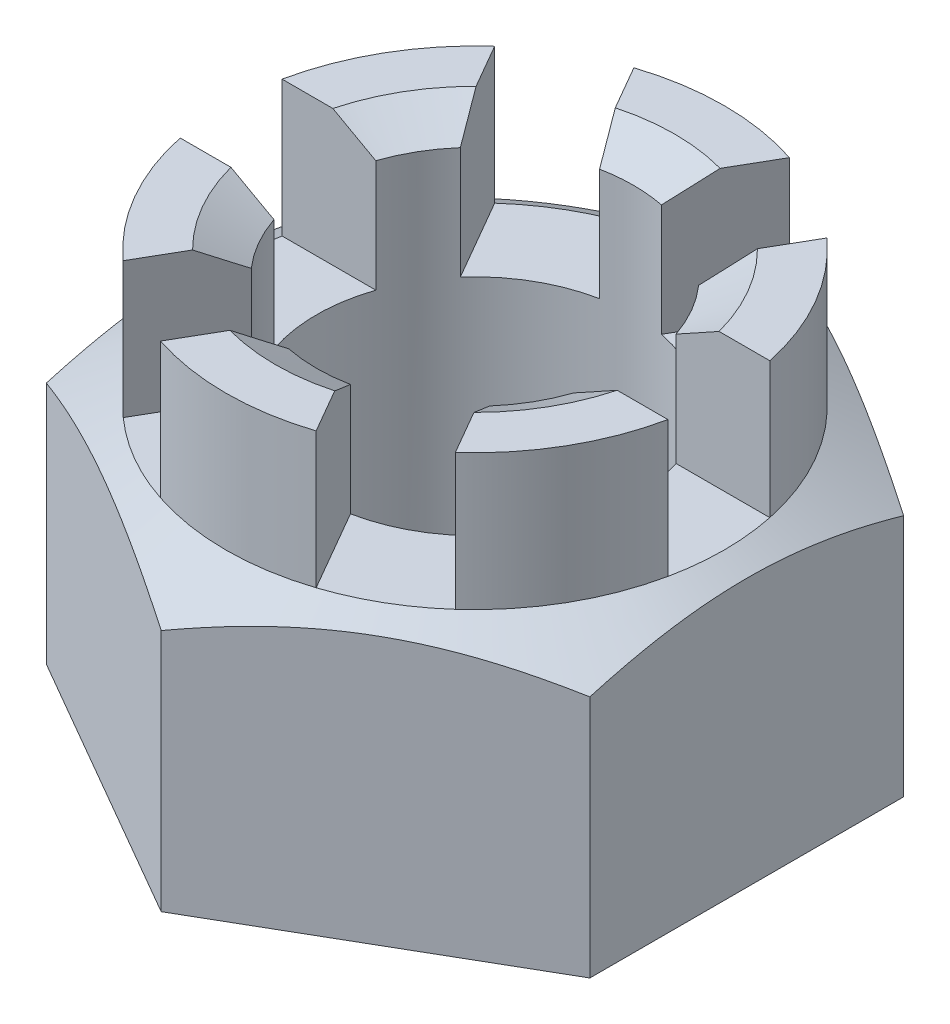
SolidWorks part; units mm, degrees
ref_plane "Front Plane" through (0, 0, 0) normal (0, 0, 1) x (1, 0, 0)
ref_plane "Top Plane" through (0, 0, 0) normal (0, 1, 0) x (1, 0, 0)
ref_plane "Right Plane" through (0, 0, 0) normal (1, 0, 0) x (0, 0, -1)
sketch "BaseNutSke" plane through (0, 0, 0) normal (0, 1, 0) x (1, 0, 0)
  line L1 (0, 13.8564) -> (-12, 6.9282)
  line L2 (-12, 6.9282) -> (-12, -6.9282)
  line L3 (-12, -6.9282) -> (0, -13.8564)
  line L4 (0, -13.8564) -> (12, -6.9282)
  line L5 (12, -6.9282) -> (12, 6.9282)
  line L6 (12, 6.9282) -> (0, 13.8564)
  circle A0 centre (0, 0) radius 12 construction
  dimension "Width" = 24
extrude "BaseNut" add sketch "BaseNutSke" along normal blind 19
sketch "CutNutSke" plane through (0, 0, 0) normal (1, 0, 0) x (0, 0, -1)
  line L0 (-13.8564, 19) -> (-11.5, 19)
  line L1 (-11.5, 19) -> (-13.8564, 17.6395)
  line L2 (-13.8564, 17.6395) -> (-13.8564, 19)
  line L3 (0, 0) -> (0, 8.4136) construction
  dimension "Chamf_ang" = 30
  dimension "Chamfer_diameter" = 23
revolve "CutNut" cut sketch "CutNutSke" angle 360 about L3
sketch "HoleSke" plane through (0, 0, 0) normal (0, 1, 0) x (1, 0, 0)
  circle A0 centre (0, 0) radius 7
  dimension "Tap_drill" = 14
extrude "TappedHole" cut sketch "HoleSke" along normal through all
chamfer "Chamfer1" distance 1.05 angle 60 2 edges at (0, 19, 7) (0, 0, 7)
sketch "SlotSke" plane through (0, 0, 0) normal (1, 0, 0) x (0, 0, -1)
  line L0 (0, 0) -> (0, 7.747) construction
  line L2 (-2.25, 32) -> (2.25, 32)
  line L3 (-2.25, 32) -> (-2.25, 13)
  line L4 (-2.25, 13) -> (2.25, 13)
  line L5 (2.25, 32) -> (2.25, 13)
  dimension "D1" = 19
  dimension "Slot_height" = 13
  dimension "Slot_width" = 4.5
extrude "Slot" cut sketch "SlotSke" against normal blind 28.8
pattern_circular "SlotPat" count 6 over 360 about axis through (0, 0, 0) along (0, 1, 0) of "Slot"
sketch "TopCutSke" plane through (0, 0, 0) normal (1, 0, 0) x (0, 0, -1)
  line L0 (-11, 32) -> (-11, 13)
  line L1 (-11, 13) -> (-33.5167, 0)
  line L2 (-33.5167, 0) -> (-33.5167, 32)
  line L3 (-33.5167, 32) -> (-11, 32)
  line L4 (0, 0) -> (0, 31.1327) construction
  dimension "D1" = 60
  dimension "Top_diameter" = 22
  dimension "D2" = 13
  dimension "D3" = 19
revolve "TopCut" cut sketch "TopCutSke" angle 360 about L4
sketch "CutBottomSke" plane through (0, 0, 0) normal (0, 1, 0) x (1, 0, 0)
  circle A0 centre (0, 0) radius 11.15
  circle A1 centre (0, 0) radius 22.3
  dimension "Bottom_diameter" = 22.3
  dimension "D2" = 44.6
extrude "CutBottom" cut sketch "CutBottomSke" along normal blind 0.6
sketch "ThdSchSke" plane through (0, 0, 0) normal (0, 0, 1) x (1, 0, 0)
  line L0 (-8, 1.6274) -> (-7, 1.05)
  line L1 (-7, 1.05) -> (-5.8453, 1.05)
  line L2 (-5.8453, 1.05) -> (-5.8453, 2.2047)
  line L3 (-5.8453, 2.2047) -> (-7, 2.2047)
  line L4 (-7, 2.2047) -> (-8, 1.6274)
  line L5 (0, -3.4988) -> (0, 3.4988) construction
  line L8 (7, 1.05) -> (-7, 1.05) construction
  line L9 (7, 1.05) -> (-7, 1.05) construction
  dimension "ThreadN" = 16
  dimension "Tap_drill" = 14
revolve "ThreadSchematic" [suppressed] cut sketch "ThdSchSke" angle 360 about L5
pattern_linear "ThdSchPat" [suppressed]
equation "\"D1@Chamfer1\" = \"Tap_drill@HoleSke\"*0.075"
equation "\"D1@SlotSke\" = \"Height@BaseNut\""
equation "\"D1@Slot\" = \"Width@BaseNutSke\"*1.2"
equation "\"D2@TopCutSke\" = \"Slot_height@SlotSke\""
equation "\"D3@TopCutSke\" = \"Height@BaseNut\""
equation "\"D2@CutBottomSke\" = \"Bottom_diameter@CutBottomSke\"*2"
equation "\"Tap_drill@ThdSchSke\" = \"Tap_drill@HoleSke\""
equation "\"ThreadN@ThdSchSke\" = \"Thread_major@ThreadCosmetic\""
equation "\"Num_threads@ThdSchPat\" =  int(( \"Height@BaseNut\" - \"D1@Chamfer1\" *2) /\"Advance@ThdSchPat\" ) "
